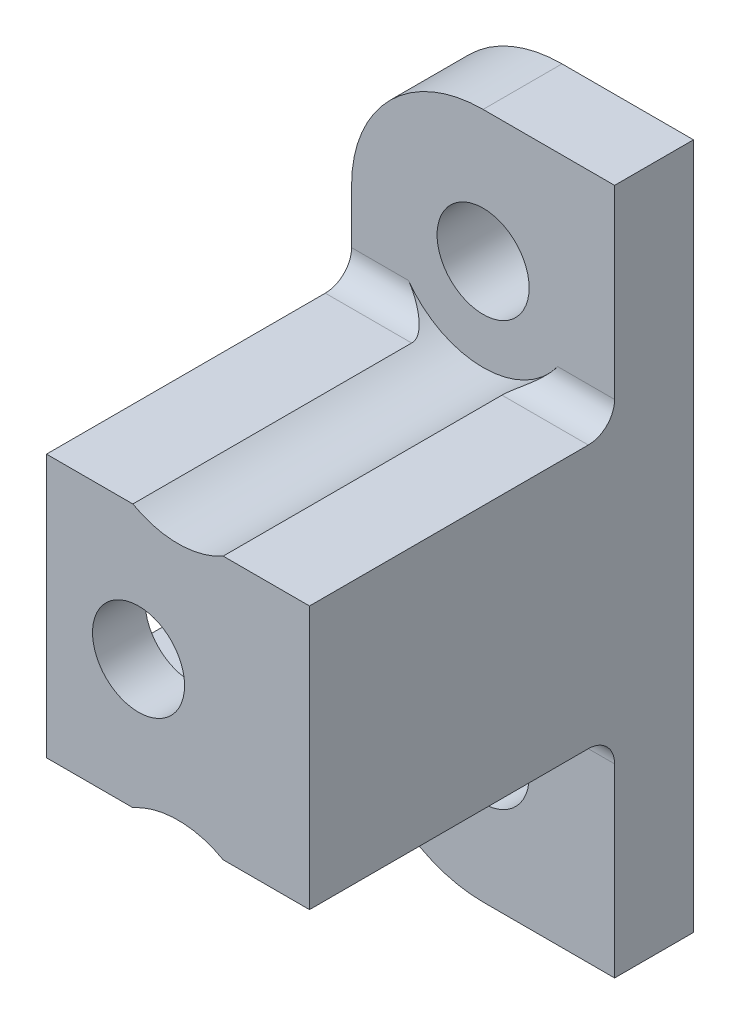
SolidWorks part; units mm, degrees
ref_plane "Front Plane" through (0, 0, 0) normal (0, 0, 1) x (1, 0, 0)
ref_plane "Top Plane" through (0, 0, 0) normal (0, 1, 0) x (1, 0, 0)
ref_plane "Right Plane" through (0, 0, 0) normal (1, 0, 0) x (0, 0, -1)
sketch "Sketch1" plane through (0, 0, 0) normal (0, 0, 1) x (1, 0, 0)
  line L1 (-5.5983, 15.5867) -> (4.4017, 15.5867)
  line L2 (-5.5983, 15.5867) -> (-5.5983, -10.5133)
  line L3 (-5.5983, -10.5133) -> (4.4017, -10.5133)
  line L4 (4.4017, 15.5867) -> (4.4017, -10.5133)
  circle A0 centre (-0.5983, 10.5867) radius 1.75
  circle A1 centre (-0.5983, -5.5133) radius 1.75
  point P8 (-0.5983, -10.5133)
  dimension "D3" = 3.5
  dimension "D4" = 3.5
  dimension "D1" = 10
  dimension "D2" = 5
  dimension "D5" = 5
  dimension "D6" = 5
  dimension "D7" = 16.1
  dimension "D8" = 5
extrude "Boss-Extrude1" add sketch "Sketch1" along normal blind 3
fillet "Fillet1" radius 5 2 edges at (-5.5983, -10.5133, 1.5) (-5.5983, 15.5867, 1.5)
ref_plane "Plane1" through (0, 0, 3) normal (0, 0, 1) x (1, 0, 0)
sketch "Sketch2" plane through (0, 0, 3) normal (0, 0, 1) x (1, 0, 0)
  line L0 (-5.5983, 10.5867) -> (-5.5983, -5.5133) construction
  line L1 (-5.5983, 7.5367) -> (4.4017, 7.5367)
  line L2 (-5.5983, 7.5367) -> (-5.5983, -2.4633)
  line L3 (-5.5983, -2.4633) -> (4.4017, -2.4633)
  line L4 (4.4017, 7.5367) -> (4.4017, -2.4633)
  line L5 (4.4017, 15.5867) -> (-0.5983, 15.5867) construction
  point P8 (1.9017, 15.5867)
  dimension "D1" = 10
  dimension "D2" = 8.05
  dimension "D3" = 10
extrude "Extrude-Thin1" add sketch "Sketch2" along normal blind 11.6 thin
ref_plane "Plane2" through (0, 0, 14.6) normal (0, 0, 1) x (1, 0, 0)
fillet "Fillet3" radius 1 8 edges at (-0.5983, 5.3367, 3) (2.2017, 2.5367, 3) (-0.5983, -0.2633, 3) (-3.3983, 2.5367, 3) (-3.3983, -0.2633, 8.8) (-3.3983, 5.3367, 8.8) (2.2017, -0.2633, 8.8) (2.2017, 5.3367, 8.8)
fillet "Fillet4" radius 1 2 edges at (-0.5983, -2.4633, 3) (-0.5983, 7.5367, 3)
sketch "Sketch10" plane through (0, 0, 14.6) normal (0, 0, 1) x (1, 0, 0)
  line L1 (-5.5983, 7.5367) -> (4.4017, 7.5367)
  line L2 (-5.5983, 7.5367) -> (-5.5983, -2.4633)
  line L3 (-5.5983, -2.4633) -> (4.4017, -2.4633)
  line L4 (4.4017, 7.5367) -> (4.4017, -2.4633)
extrude "Boss-Extrude4" add sketch "Sketch10" against normal blind 7
ref_plane "Plane4" through (0, 0, 12.6) normal (0, 0, 1) x (1, 0, 0)
sketch "Sketch12" plane through (0, 0, 12.6) normal (0, 0, 1) x (1, 0, 0)
  line L0 (-5.5983, 7.5367) -> (-5.5983, -2.4633) construction
  line L1 (-5.5983, 5.4367) -> (1.3017, 5.4367)
  line L2 (-5.5983, 5.4367) -> (-5.5983, -0.3633)
  line L3 (-5.5983, -0.3633) -> (1.3017, -0.3633)
  line L4 (1.3017, 5.4367) -> (1.3017, -0.3633)
  line L5 (4.4017, 7.5367) -> (-5.5983, 7.5367) construction
  dimension "D1" = 2.1
  dimension "D2" = 6.9
extrude "Cut-Extrude5" cut sketch "Sketch12" against normal blind 2.8
sketch "Sketch8" plane through (0, 0, 14.6) normal (0, 0, 1) x (1, 0, 0)
  circle A1 centre (-0.5983, 10.5867) radius 3.5
  circle A2 centre (-0.5983, -5.5133) radius 3.5
  dimension "D3" = 7
  dimension "D4" = 7
extrude "Cut-Extrude3" cut sketch "Sketch8" against normal up to surface (11.6 mm away)
sketch "Sketch13" plane through (0, 0, 14.6) normal (0, 0, 1) x (1, 0, 0)
  line L0 (-5.5983, 7.5367) -> (-5.5983, -2.4633) construction
  line L1 (-2.3151, 7.5367) -> (-5.5983, 7.5367) construction
  circle A0 centre (-2.0983, 2.5367) radius 1.75
  dimension "D1" = 3.5
  dimension "D2" = 3.5
  dimension "D3" = 5
extrude "Cut-Extrude6" cut sketch "Sketch13" against normal blind 17.8
